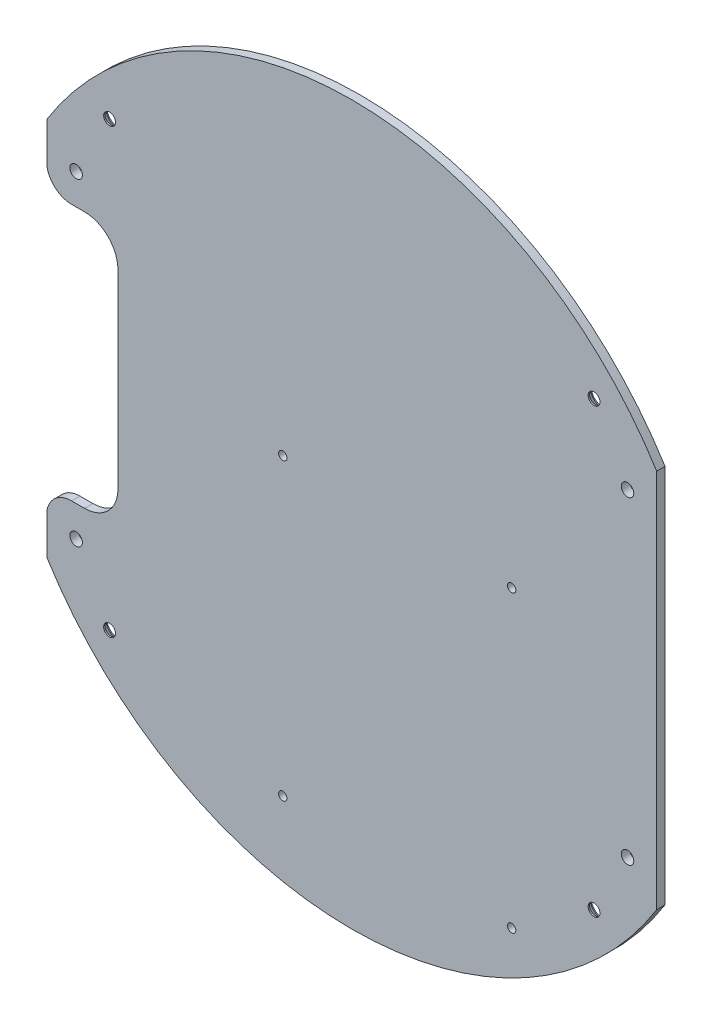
SolidWorks part; units mm, degrees
ref_plane "Front" through (0, 0, 0) normal (0, 0, 1) x (1, 0, 0)
ref_plane "Top" through (0, 0, 0) normal (0, 1, 0) x (1, 0, 0)
ref_plane "Right" through (0, 0, 0) normal (1, 0, 0) x (0, 0, -1)
sketch "Sketch1" plane through (0, 0, 0) normal (0, 0, 1) x (1, 0, 0)
  line L0 (-115.8875, -63.5) -> (115.8875, -63.5)
  line L1 (0, 0) -> (0, -63.5) construction
  line L2 (-115.8875, 8.6745) -> (-115.8875, -63.5)
  line L3 (115.8875, 8.6745) -> (115.8875, -63.5)
  arc A0 (62.217, -63.5) -> (-62.217, -63.5) centre (0, 0) ccw construction
  arc A1 (115.8875, 8.6745) -> (-115.8875, 8.6745) centre (0, -63.5) ccw
  circle A2 centre (0, 0) radius 76.2 construction
  circle A3 centre (0, -63.5) radius 126.5936 construction
  circle A4 centre (0, -63.5) radius 114.3 construction
  dimension "D1" = 177.8
  dimension "D2" = 63.5
  dimension "D4" = 273.05
  dimension "D5" = 63.5
  dimension "D6" = 115.8875
  dimension "D7" = 115.8875
  dimension "D8" = 228.6
  dimension "D9" = 253.1872
  dimension "D3" = 152.4
extrude "Base-Extrude" add sketch "Sketch1" along normal blind 3.175
sketch "Sketch14" plane through (0, 0, 3.175) normal (0, 0, 1) x (1, 0, 0)
  line L0 (-116.0441, -5.1685) -> (-128.0671, -5.1685)
  line L1 (-115.8875, 8.6745) -> (-115.8875, -63.5) construction
  line L2 (28.575, 82.935) -> (-28.575, 82.935) construction
  line L5 (0, -63.5) -> (0, -186.2328) construction
  line L6 (-22.225, 38.1) -> (22.225, 38.1) construction
  line L7 (-106.5191, -14.6935) -> (-101.6, -14.6935)
  line L13 (28.575, 82.935) -> (28.575, 44.45) construction
  line L14 (-28.575, 82.935) -> (-28.575, 44.45) construction
  line L15 (-128.0671, -5.1685) -> (-128.0671, -87.9817)
  line L16 (-128.0671, -87.9817) -> (-88.9, -87.9817)
  line L17 (-88.9, -27.3935) -> (-88.9, -87.9817)
  line L20 (96.8375, -14.152) -> (88.9, -27.9001) construction
  line L21 (88.9, -27.9001) -> (88.9, -87.9817) construction
  line L22 (128.0671, -87.9817) -> (88.9, -87.9817) construction
  line L23 (128.0671, -14.152) -> (128.0671, -87.9817) construction
  line L24 (128.0671, -14.152) -> (96.8375, -14.152) construction
  arc A0 (-88.9, -27.3935) -> (-101.6, -14.6935) centre (-101.6, -27.3935) ccw
  arc A1 (-116.0441, -5.1685) -> (-106.5191, -14.6935) centre (-106.5191, -5.1685) ccw
  arc A4 (22.225, 38.1) -> (28.575, 44.45) centre (22.225, 44.45) ccw construction
  arc A7 (-28.575, 44.45) -> (-22.225, 38.1) centre (-22.225, 44.45) ccw construction
  dimension "D2" = 26.9875
  dimension "D3" = 12.7
  dimension "D4" = 9.525
  dimension "D11" = 6.35
  dimension "D7" = 23.368
  dimension "D13" = 57.15
extrude "Pass-Thru" cut sketch "Sketch14" against normal through all
ref_plane "CenterLine-Plane10" through (0, -63.5, 0) normal (0, 1, 0) x (-1, 0, 0)
mirror "Mirror2" about plane through (0, -63.5, 0) normal (0, 1, 0) of "Base-Extrude", "Pass-Thru"
sketch "Sketch38" plane through (0, 0, 3.175) normal (0, 0, 1) x (1, 0, 0)
  line L0 (0, -63.5) -> (157.2463, -63.5) construction
  line L1 (0, -63.5) -> (138.9034, 16.6959) construction
  line L2 (0, -63.5) -> (0, -98.6999) construction
  circle A0 centre (0, -63.5) radius 121.0056 construction
  circle A1 centre (104.7939, -2.9972) radius 2.3813
  circle A2 centre (104.7939, -124.0028) radius 2.3813
  circle A3 centre (-104.7939, -124.0028) radius 2.3813
  circle A4 centre (-104.7939, -2.9972) radius 2.3813
  dimension "D1" = 242.0112
  dimension "D2" = 4.7625
  dimension "D3" = 30
extrude "#8 Mount Holes" cut sketch "Sketch38" against normal through all
sketch "Sketch39" plane through (0, 0, 0) normal (0, 0, -1) x (-1, 0, 0)
  line L0 (35.306, -176.911) -> (-69.6976, -176.911) construction
  line L1 (-85.1916, -92.71) -> (-85.1916, -50.8) construction
  line L2 (-85.1916, -50.8) -> (35.306, -50.8) construction
  line L3 (50.8, -56.4554) -> (50.8, -171.2556) construction
  line L4 (50.8, -56.4554) -> (35.306, -56.4554) construction
  line L5 (0, -51.8882) -> (0, 0) construction
  line L6 (35.306, -56.4554) -> (35.306, -50.8) construction
  line L7 (50.8, -171.2556) -> (35.306, -171.2556) construction
  line L8 (35.306, -171.2556) -> (35.306, -176.911) construction
  line L9 (-69.6976, -176.911) -> (-69.6976, -92.71) construction
  line L10 (-69.6976, -92.71) -> (-85.1916, -92.71) construction
  line L11 (88.9, -63.5) -> (-115.8875, -63.5) construction
  line L12 (88.9, -99.6065) -> (88.9, -27.3935) construction
  line L13 (-115.8875, -135.6745) -> (-115.8875, 8.6745) construction
  circle A0 centre (26.2509, -169.291) radius 1.5875
  circle A1 centre (26.2509, -57.277) radius 1.5875
  circle A2 centre (-60.7441, -57.277) radius 1.5875
  circle A3 centre (-60.7441, -169.291) radius 1.5875
  dimension "D5" = 112.014
  dimension "D6" = 86.995
  dimension "D7" = 7.62
  dimension "D10" = 3.175
  dimension "D11" = 108.839
  dimension "D12" = 83.82
  dimension "D13" = 50.8
  dimension "D1" = 135.9916
  dimension "D2" = 126.111
  dimension "D3" = 15.494
  dimension "D4" = 7.366
  dimension "D8" = 41.91
  dimension "D9" = 15.494
  dimension "D14" = 85.1916
  dimension "D15" = 12.7
extrude "Relay Board" cut sketch "Sketch39" against normal through all
hole_wizard "CSK for #8 Flat Head Machine Screw1" positions "Sketch42" profile "Sketch41" countersink size "#8" standard "Ansi Inch"
sketch "Sketch42" plane through (0, 0, 0) normal (0, 0, -1) x (-1, 0, 0)
  line L0 (88.9, -63.5) -> (-115.8875, -63.5) construction
  line L1 (88.9, -99.6065) -> (88.9, -27.3935) construction
  line L2 (-115.8875, -135.6745) -> (-115.8875, 8.6745) construction
  point P0 (92.075, -147.6375)
  point P1 (92.075, 20.6375)
  point P11 (-92.075, 20.6375)
  point P13 (-92.075, -147.6375)
  dimension "D1" = 92.075
  dimension "D2" = 84.1375
  dimension "D3" = 84.1375
  dimension "D4" = 92.075
sketch "Sketch41" plane through (-92.075, -147.6375, 0) normal (1, 0, 0) x (0, 1, 0)
  line L0 (0, 0) -> (0, 3.175)
  line L1 (0, 3.175) -> (2.2479, 3.175)
  line L2 (2.2479, 3.175) -> (2.2479, 2.6455)
  line L3 (2.2479, 2.6455) -> (4.2164, 0.381)
  line L4 (4.2164, 0.381) -> (4.2164, 0)
  line L6 (4.2164, 0) -> (0, 0)
  line L7 (-2.2479, 2.6455) -> (-4.2164, 0.381) construction
  line L11 (0, -6.35) -> (0, 107.95) construction
  dimension "Thru Hole Dia." = 4.4958
  dimension "Thru Hole Depth" = 3.175
  dimension "C'Sink Dia." = 8.4328
  dimension "C'Sink Angle" = 82
  dimension "Head Clearance" = 0.381
